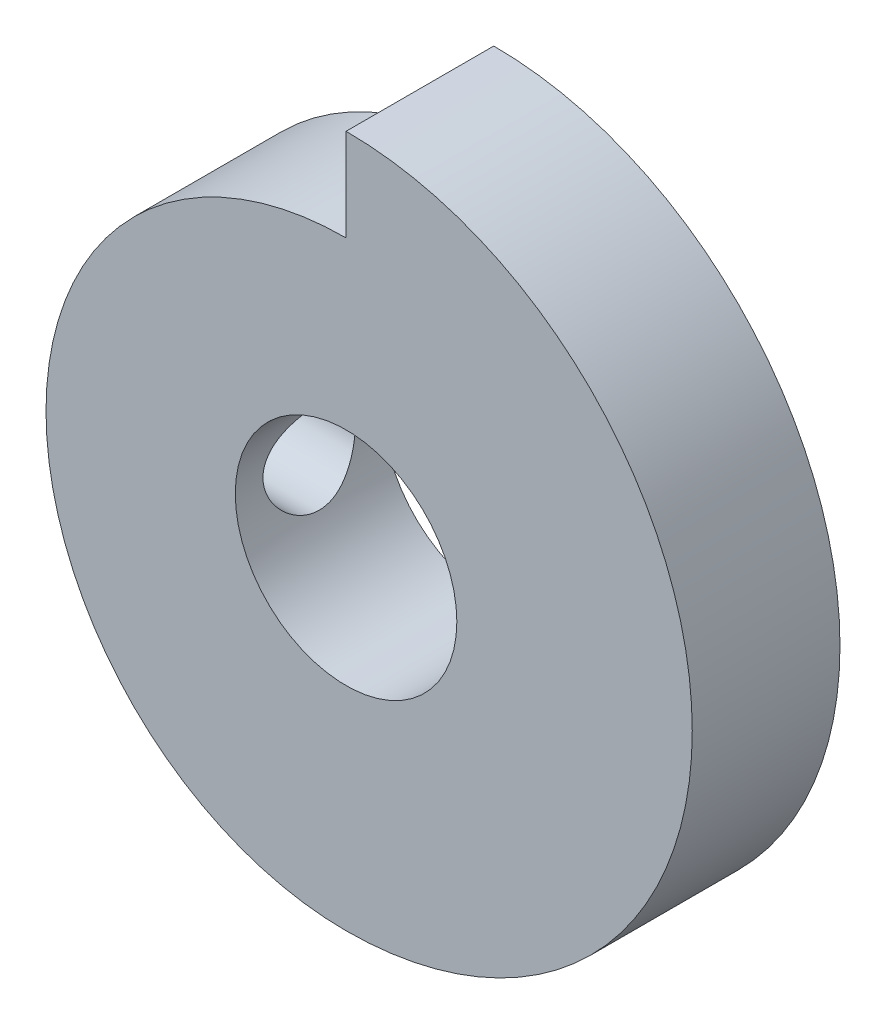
SolidWorks part; units mm, degrees
ref_plane "Plan de face" through (0, 0, 0) normal (0, 0, 1) x (1, 0, 0)
ref_plane "Plan de dessus" through (0, 0, 0) normal (0, 1, 0) x (1, 0, 0)
ref_plane "Plan de droite" through (0, 0, 0) normal (1, 0, 0) x (0, 0, -1)
sketch "Esquisse1" plane through (0, 0, 0) normal (0, 0, 1) x (1, 0, 0)
  line L0 (0, 11.8799) -> (0, -13.7253) construction
  line L1 (-13.4546, 0) -> (13.3809, 0) construction
  line L2 (0, 10) -> (0, 7.5)
  arc A0 (0, 10) -> (0, -8.75) centre (0, 0.625) cw
  circle A1 centre (0, 0) radius 3
  arc A2 (0, -8.75) -> (0, 7.5) centre (0, -0.625) cw
  point P6 (0, -8.75)
  dimension "D1" = 6
  dimension "D2" = 7.5
  dimension "D3" = 10
  dimension "D4" = 8.75
extrude "Boss.-Extru.1" add sketch "Esquisse1" along normal blind 4
sketch "Esquisse2" plane through (0, 0, 0) normal (1, 0, 0) x (0, 0, -1)
  line L0 (3.0057, 0) -> (-6.3253, 0) construction
  line L1 (-2, 10.6728) -> (-2, -10.1039) construction
  circle A0 centre (-2, 0) radius 1.25
  dimension "D1" = 2
  dimension "D2" = 2.5
extrude "Enlèv. mat.-Extru.1" cut sketch "Esquisse2" against normal blind 10
chamfer "Chanfrein1" distance 0.2 angle 45 1 edges at (-8.1175, -0.2752, 3.2193)
